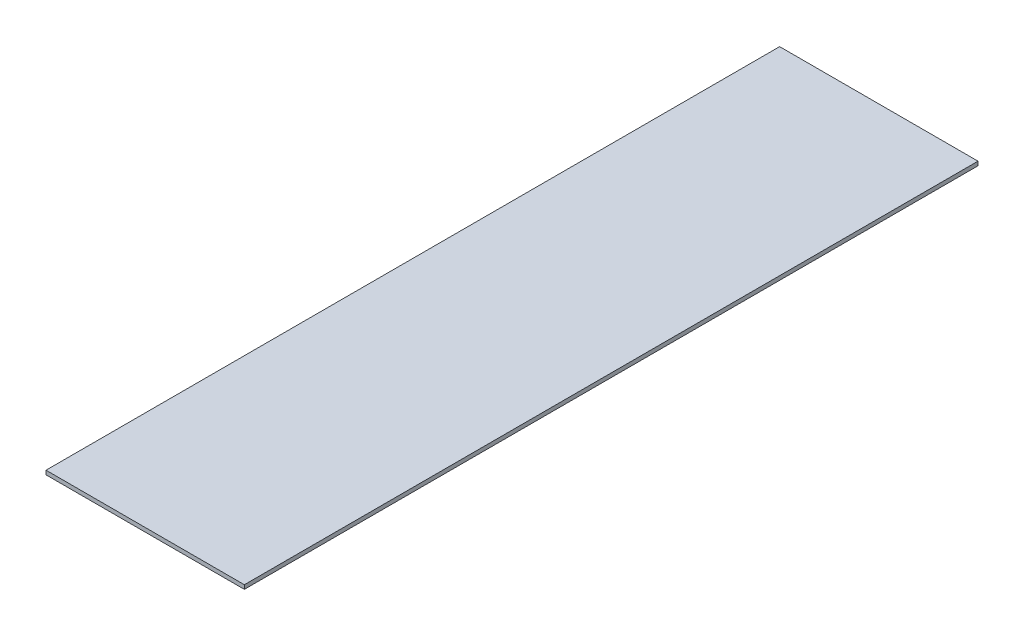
SolidWorks part; units mm, degrees
ref_plane "Front Plane" through (0, 0, 0) normal (0, 0, 1) x (1, 0, 0)
ref_plane "Top Plane" through (0, 0, 0) normal (0, 1, 0) x (1, 0, 0)
ref_plane "Right Plane" through (0, 0, 0) normal (1, 0, 0) x (0, 0, -1)
sketch "Sketch1" plane through (0, 0, 0) normal (0, 1, 0) x (1, 0, 0)
  line L0 (0, 200.1296) -> (0, 39.3856) construction
  line L1 (-12.3027, 200.1296) -> (12.3027, 200.1296)
  line L2 (-12.3027, 200.1296) -> (-12.3027, 109.1296)
  line L3 (-12.3027, 109.1296) -> (12.3027, 109.1296)
  line L4 (12.3027, 200.1296) -> (12.3027, 109.1296)
  point P7 (0, 109.1296)
  dimension "D1" = 24.6054
  dimension "D3" = 109.1296
  dimension "D4" = 91
extrude "Boss-Extrude1" add sketch "Sketch1" along normal blind 0.5
